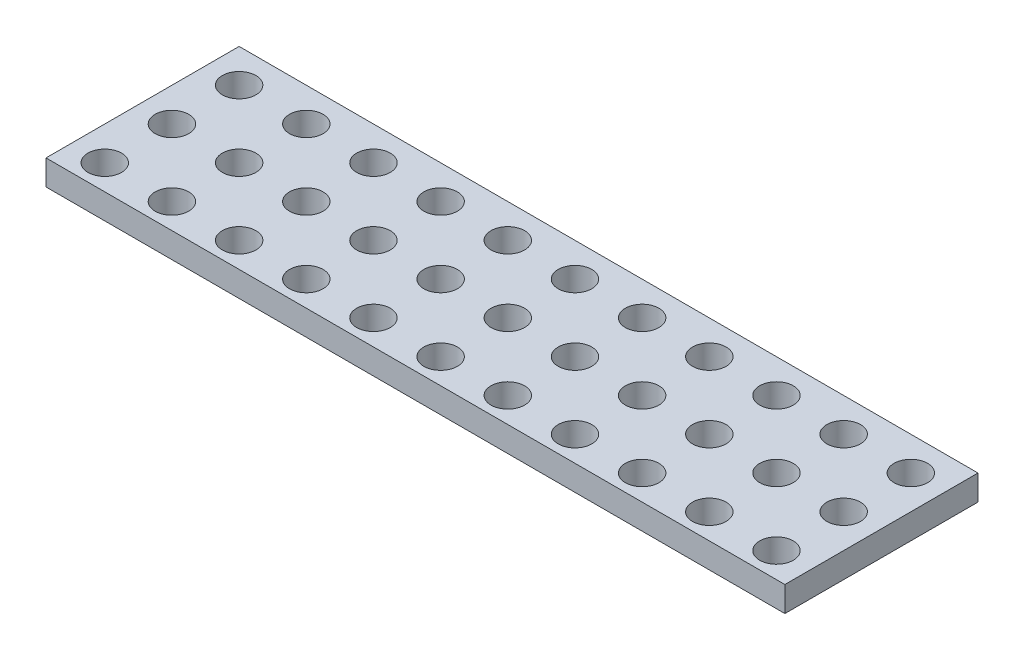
SolidWorks part; units mm, degrees
ref_plane "前视基准面" through (0, 0, 0) normal (0, 0, 1) x (1, 0, 0)
ref_plane "上视基准面" through (0, 0, 0) normal (0, 1, 0) x (1, 0, 0)
ref_plane "右视基准面" through (0, 0, 0) normal (1, 0, 0) x (0, 0, -1)
sketch "草图1" plane through (0, 0, 0) normal (0, 1, 0) x (1, 0, 0)
  line L1 (-24.5926, 11.7037) -> (63.4074, 11.7037)
  line L2 (-24.5926, 11.7037) -> (-24.5926, -11.2963)
  line L3 (-24.5926, -11.2963) -> (63.4074, -11.2963)
  line L4 (63.4074, 11.7037) -> (63.4074, -11.2963)
  circle A0 centre (-20.5926, 7.7037) radius 2
  circle A1 centre (-12.5926, 7.7037) radius 2
  circle A2 centre (-4.5926, 7.7037) radius 2
  circle A3 centre (3.4074, 7.7037) radius 2
  circle A4 centre (11.4074, 7.7037) radius 2
  circle A5 centre (19.4074, 7.7037) radius 2
  circle A6 centre (27.4074, 7.7037) radius 2
  circle A7 centre (35.4074, 7.7037) radius 2
  circle A8 centre (43.4074, 7.7037) radius 2
  circle A9 centre (51.4074, 7.7037) radius 2
  circle A10 centre (59.4074, 7.7037) radius 2
  circle A12 centre (67.4074, 7.7037) radius 2
  circle A13 centre (-12.5926, -0.2963) radius 2
  circle A14 centre (-4.5926, -0.2963) radius 2
  circle A15 centre (3.4074, -0.2963) radius 2
  circle A16 centre (11.4074, -0.2963) radius 2
  circle A17 centre (19.4074, -0.2963) radius 2
  circle A18 centre (27.4074, -0.2963) radius 2
  circle A19 centre (35.4074, -0.2963) radius 2
  circle A20 centre (43.4074, -0.2963) radius 2
  circle A21 centre (51.4074, -0.2963) radius 2
  circle A22 centre (59.4074, -0.2963) radius 2
  circle A23 centre (-20.5926, -0.2963) radius 2
  circle A24 centre (-12.5926, -8.2963) radius 2
  circle A25 centre (-4.5926, -8.2963) radius 2
  circle A26 centre (3.4074, -8.2963) radius 2
  circle A27 centre (11.4074, -8.2963) radius 2
  circle A28 centre (19.4074, -8.2963) radius 2
  circle A29 centre (27.4074, -8.2963) radius 2
  circle A30 centre (35.4074, -8.2963) radius 2
  circle A31 centre (43.4074, -8.2963) radius 2
  circle A32 centre (51.4074, -8.2963) radius 2
  circle A33 centre (59.4074, -8.2963) radius 2
  circle A34 centre (-20.5926, -8.2963) radius 2
  point P6 (0, 0)
  point P75 (-24.0254, -11.2963)
  dimension "D3" = 4
  dimension "D1" = 88
  dimension "D2" = 23
  dimension "D4" = 4
  dimension "D12" = 5
  dimension "D5" = 2
  dimension "D6" = 2
  dimension "D7" = 2
  dimension "D8" = 2
  dimension "D9" = 2
  dimension "D10" = 2
  dimension "D11" = 2
extrude "凸台-拉伸1" add sketch "草图1" along normal blind 3
